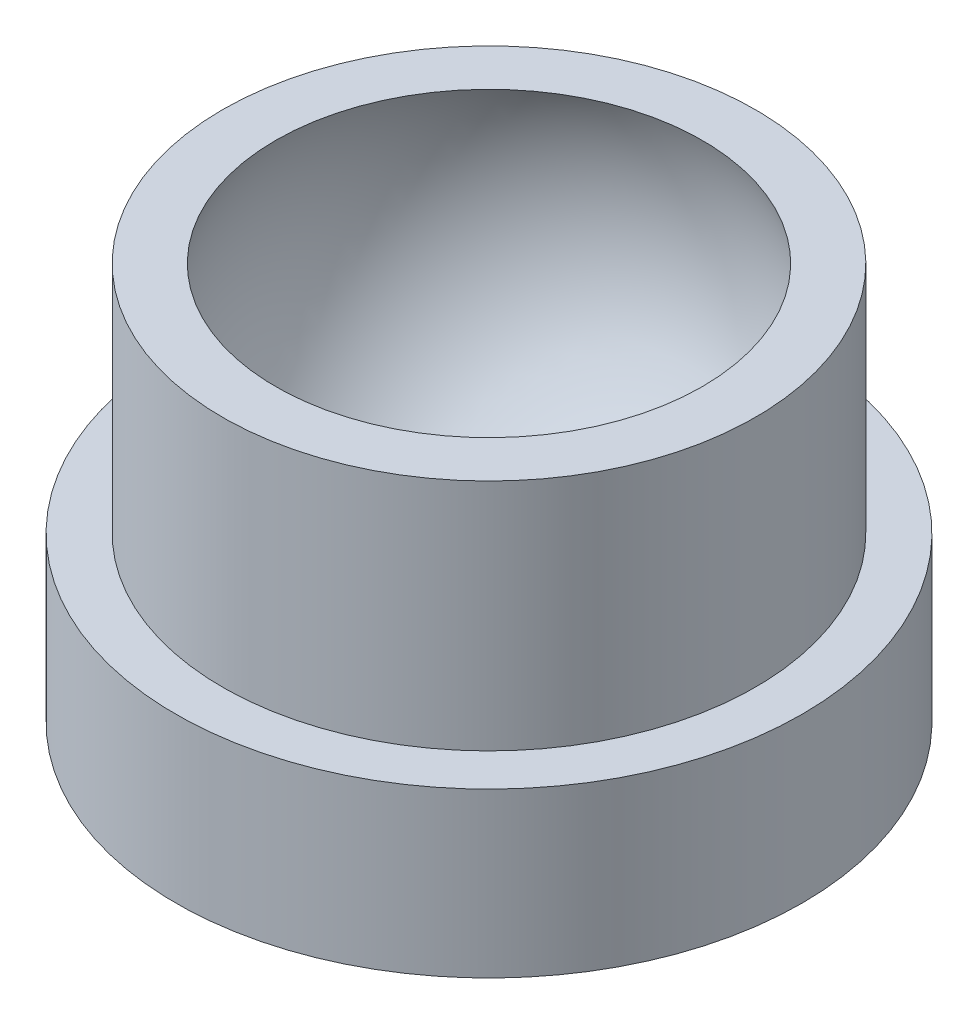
SolidWorks part; units mm, degrees
ref_plane "Front Plane" through (0, 0, 0) normal (0, 0, 1) x (1, 0, 0)
ref_plane "Top Plane" through (0, 0, 0) normal (0, 1, 0) x (1, 0, 0)
ref_plane "Right Plane" through (0, 0, 0) normal (1, 0, 0) x (0, 0, -1)
sketch "Sketch1" plane through (0, 0, 0) normal (0, 0, 1) x (1, 0, 0)
  line L0 (0, 0) -> (2.54, 0)
  line L1 (34.036, 0) -> (34.036, -8.89)
  line L2 (34.036, -8.89) -> (0, -8.89)
  line L3 (0, -8.89) -> (0, 0)
  line L4 (2.54, 0) -> (2.54, 12.7)
  line L5 (2.54, 12.7) -> (31.496, 12.7)
  line L6 (31.496, 12.7) -> (31.496, 0)
  line L7 (31.496, 0) -> (34.036, 0)
  line L8 (17.018, 12.7) -> (17.018, -8.89)
  point P7 (17.018, 12.7)
  point P11 (17.018, -8.89)
  dimension "D1" = 34.036
  dimension "D2" = 8.89
  dimension "D3" = 12.7
  dimension "D4" = 28.956
revolve "Revolve1" add sketch "Sketch1" angle 360 about L8
sketch "Sketch2" plane through (0, 0, 0) normal (0, 0, 1) x (1, 0, 0)
  line L2 (4.318, 7.5108) -> (29.718, 7.5108)
  line L3 (31.496, 12.7) -> (2.54, 12.7) construction
  arc A0 (29.718, 7.5108) -> (4.318, 7.5108) centre (17.018, 7.5108) ccw
  point P5 (16.4051, 7.5108)
  dimension "D1" = 25.4
  dimension "D2" = 5.1892
  dimension "D3" = 14.478
revolve "Cut-Revolve1" cut sketch "Sketch2" angle 360 about L2
